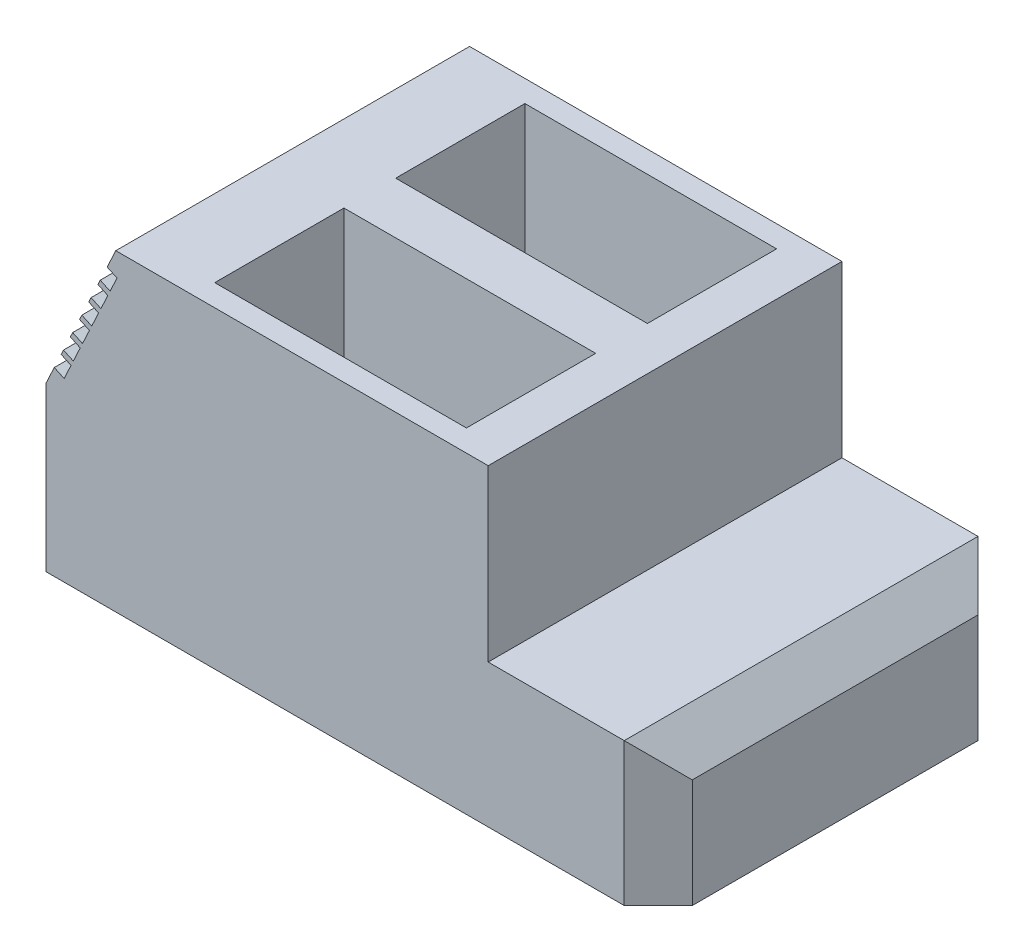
SolidWorks part; units mm, degrees
ref_plane "Front" through (0, 0, 0) normal (0, 0, 1) x (1, 0, 0)
ref_plane "Top" through (0, 0, 0) normal (0, 1, 0) x (1, 0, 0)
ref_plane "Right" through (0, 0, 0) normal (1, 0, 0) x (0, 0, -1)
sketch "Sketch1" plane through (0, 0, 0) normal (0, 0, 1) x (1, 0, 0)
  line L0 (-225, 120) -> (-173.7062, 230)
  line L1 (-173.7062, 230) -> (100, 230)
  line L2 (-225, 120) -> (-225, 0)
  line L3 (-225, 0) -> (225, 0)
  line L4 (225, 105) -> (225, 0)
  line L5 (100, 230) -> (100, 105)
  line L6 (100, 105) -> (225, 105)
  dimension "D1" = 450
  dimension "D2" = 105
  dimension "D3" = 230
  dimension "D4" = 125
  dimension "D5" = 120
  dimension "D6" = 25
extrude "Boss-Extrude1" add sketch "Sketch1" along normal mid plane 260
sketch "Sketch2" plane through (0, 230, 0) normal (0, 1, 0) x (1, 0, 0)
  line L0 (100, -130) -> (-173.7062, -130) construction
  line L1 (-117, -19) -> (68, -19)
  line L2 (-117, -19) -> (-117, -114)
  line L3 (-117, -114) -> (68, -114)
  line L4 (68, -19) -> (68, -114)
  line L5 (100, -130) -> (100, 130) construction
  dimension "D1" = 16
  dimension "D2" = 32
  dimension "D3" = 185
  dimension "D4" = 95
extrude "Cut-Extrude1" cut sketch "Sketch2" against normal through all
sketch "Sketch5" plane through (0, 0, 130) normal (0, 0, 1) x (1, 0, 0)
  line L0 (-180.0454, 216.4054) -> (-172.795, 213.0244)
  line L1 (-173.7062, 230) -> (-225, 120) construction
  line L2 (-172.795, 213.0244) -> (-177.8664, 202.1487)
  line L3 (-177.8664, 202.1487) -> (-185.1169, 205.5297)
  line L4 (-185.1169, 205.5297) -> (-180.0454, 216.4054)
  dimension "D1" = 15
  dimension "D2" = 12
  dimension "D3" = 8
extrude "Cut-Extrude2" cut sketch "Sketch5" against normal blind 80
pattern_linear "LPattern1" count 6 spacing 16 along (-0.4226, -0.9063, 0) of "Cut-Extrude2"
mirror "Mirror1" about plane through (0, 0, 0) normal (0, 0, 1) of "LPattern1", "Cut-Extrude1", "Cut-Extrude2"
chamfer "Chamfer1" distance 25 angle 45 3 edges at (225, 52.5, -130) (225, 105, 0) (225, 52.5, 130)
sketch "Sketch7" plane through (0, 0, 0) normal (0, -1, 0) x (1, 0, 0)
  line L0 (0, 0) -> (118, 0) construction
  line L1 (118, 80) -> (198, 80)
  line L2 (118, 80) -> (118, -80)
  line L3 (118, -80) -> (198, -80)
  line L4 (198, 80) -> (198, -80)
  line L5 (225, 105) -> (225, -105) construction
  line L6 (0, 0) -> (-135, 0) construction
  line L7 (-185, 60) -> (-135, 60)
  line L8 (-185, 60) -> (-185, -60)
  line L9 (-185, -60) -> (-135, -60)
  line L10 (-135, 60) -> (-135, -60)
  line L11 (-225, 130) -> (-225, -130) construction
  dimension "D1" = 27
  dimension "D2" = 160
  dimension "D3" = 80
  dimension "D4" = 40
  dimension "D5" = 50
  dimension "D6" = 120
extrude "Cut-Extrude3" cut sketch "Sketch7" against normal blind 70
fillet "Fillet1" radius 12 8 edges at (198, 35, -80) (198, 35, 80) (118, 35, -80) (118, 35, 80) (-135, 35, -60) (-135, 35, 60) (-185, 35, -60) (-185, 35, 60)
